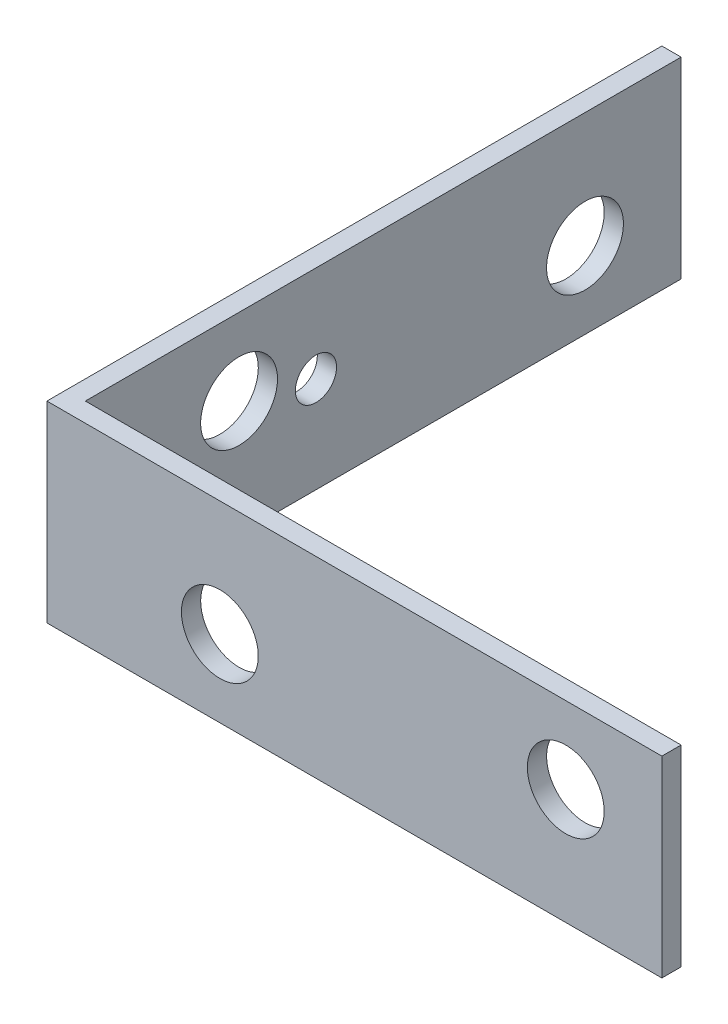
SolidWorks part; units mm, degrees
ref_plane "Front Plane" through (0, 0, 0) normal (0, 0, 1) x (1, 0, 0)
ref_plane "Top Plane" through (0, 0, 0) normal (0, 1, 0) x (1, 0, 0)
ref_plane "Right Plane" through (0, 0, 0) normal (1, 0, 0) x (0, 0, -1)
sketch "Sketch1" plane through (0, 0, 0) normal (0, 1, 0) x (1, 0, 0)
  line L0 (0, 0) -> (-50.8, 0)
  line L1 (-50.8, 0) -> (-50.8, 50.8)
  line L2 (-50.8, 50.8) -> (-49.2125, 50.8)
  line L3 (-49.2125, 50.8) -> (-49.2125, 1.5875)
  line L4 (0, 0) -> (0, 1.5875)
  line L5 (0, 1.5875) -> (-49.2125, 1.5875)
  dimension "D1" = 50.8
  dimension "D2" = 50.8
extrude "Extrude1" add sketch "Sketch1" along normal blind 15.875
sketch "Sketch2" plane through (0, 0, -1.5875) normal (0, 0, -1) x (-1, 0, 0)
  line L0 (0, 15.875) -> (0, 0) construction
  line L2 (0, 15.875) -> (49.2125, 15.875) construction
  line L4 (0, 0) -> (49.2125, 0) construction
  circle A0 centre (7.9375, 9.525) radius 3.175
  circle A1 centre (36.5125, 6.35) radius 3.175
  dimension "D1" = 7.9375
  dimension "D2" = 6.35
  dimension "D3" = 6.35
  dimension "D4" = 28.575
extrude "Extrude2" cut sketch "Sketch2" against normal through all
sketch "Sketch3" plane through (-49.2125, 0, 0) normal (1, 0, 0) x (0, 0, -1)
  line L3 (1.5875, 15.875) -> (50.8, 15.875) construction
  line L5 (1.5875, 0) -> (50.8, 0) construction
  line L6 (50.8, 15.875) -> (50.8, 0) construction
  circle A0 centre (42.8625, 6.35) radius 3.175
  circle A1 centre (14.2875, 9.525) radius 3.175
  dimension "D1" = 28.575
  dimension "D2" = 6.35
  dimension "D3" = 6.35
  dimension "D4" = 7.9375
  dimension "D5" = 6.35
extrude "Extrude4" cut sketch "Sketch3" against normal through all
sketch "Sketch4" plane through (-49.2125, 0, 0) normal (1, 0, 0) x (0, 0, -1)
  line L0 (1.5875, 0) -> (50.8, 0) construction
  line L1 (1.5875, 15.875) -> (1.5875, 0) construction
  circle A0 centre (20.6375, 7.9375) radius 1.7
  dimension "D1" = 19.05
  dimension "D2" = 7.9375
extrude "Extrude5" cut sketch "Sketch4" against normal through all
